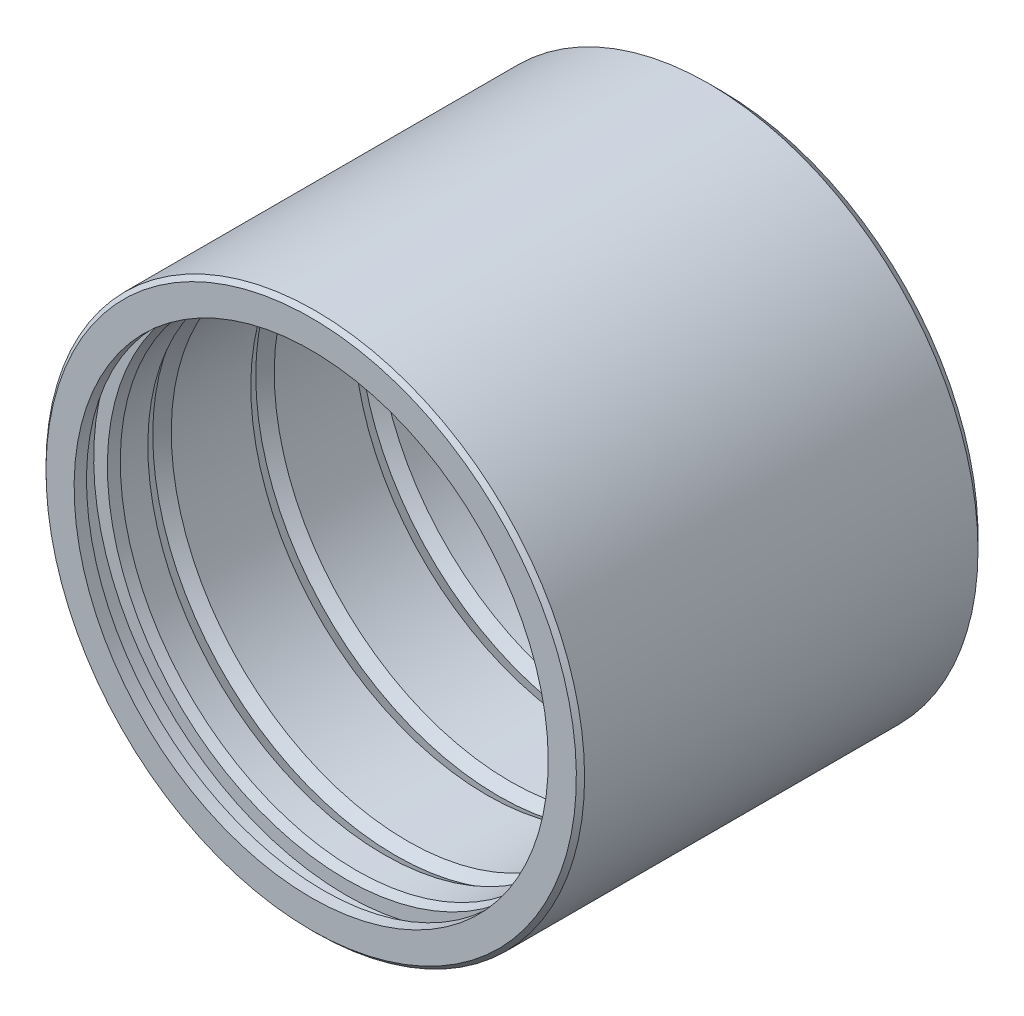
SolidWorks part; units mm, degrees
ref_plane "Front Plane" through (0, 0, 0) normal (0, 0, 1) x (1, 0, 0)
ref_plane "Top Plane" through (0, 0, 0) normal (0, 1, 0) x (1, 0, 0)
ref_plane "Right Plane" through (0, 0, 0) normal (1, 0, 0) x (0, 0, -1)
sketch "Sketch1" plane through (0, 0, 0) normal (1, 0, 0) x (0, 0, -1)
  line L0 (-114.4056, 0) -> (114.4056, 0) construction
  line L2 (-97.5, -115.1) -> (-91.5, -115.1)
  line L3 (-91.5, -115.1) -> (-91.5, -122.6)
  line L4 (-91.5, -122.6) -> (-80.5, -122.6)
  line L5 (-80.5, -122.6) -> (-80.5, -115.95)
  line L6 (-80.5, -115.95) -> (-75.555, -114.625)
  line L7 (-75.555, -114.625) -> (-62.1898, -114.625)
  line L8 (-62.1898, -114.625) -> (-56.5, -117.91)
  line L9 (-56.5, -117.91) -> (-50.8102, -114.625)
  line L10 (-50.8102, -114.625) -> (-12.1898, -114.625)
  line L11 (-12.1898, -114.625) -> (-6.5, -117.91)
  line L12 (-6.5, -117.91) -> (-0.8102, -114.625)
  line L13 (-0.8102, -114.625) -> (37.8102, -114.625)
  line L14 (37.8102, -114.625) -> (43.5, -117.91)
  line L15 (43.5, -117.91) -> (49.1898, -114.625)
  line L17 (93.0096, -114.625) -> (101.5, -116.9)
  line L18 (101.5, -116.9) -> (101.5, -124.75)
  line L19 (101.5, -124.75) -> (95.5, -130.75)
  line L20 (95.5, -130.75) -> (-95.5, -130.75)
  line L21 (-95.5, -130.75) -> (-97.5, -128.75)
  line L22 (-97.5, -128.75) -> (-97.5, -115.1)
  line L23 (-97.5, -128.75) -> (-101.5, -124.75) construction
  line L24 (-101.5, -124.75) -> (-101.5, -115.1) construction
  line L25 (-101.5, -115.1) -> (-97.5, -115.1) construction
  line L26 (98.5, -39.1266) -> (98.5, -163.3534) construction
  line L27 (-56.5, -117.91) -> (43.5, -117.91) construction
  line L28 (-56.5, -117.91) -> (-56.5, 78.762) construction
  line L29 (-6.5, -117.91) -> (-6.5, 78.4795) construction
  line L30 (43.5, -117.91) -> (43.5, 78.4795) construction
  line L31 (0, 0) -> (0, -199.431) construction
  line L32 (49.1898, -114.625) -> (93.0096, -114.625)
  point P4 (0, 0)
  point P6 (0, -130.75)
  point P30 (-6.5, -94.0752)
  point P34 (0, 0)
  point P36 (0, 0)
  point P37 (43.5, -93.8879)
  point P38 (0, 0)
  point P39 (95.5, -86.4869)
  point P40 (0, 0)
  point P41 (0, 0)
  point P42 (43.5, -93.8879)
  point P43 (0, 0)
  point P44 (0, 0)
  point P45 (0, 0)
  point P46 (-70.7866, -113.6631)
  point P47 (0, 0)
  point P48 (73.1711, -115.025)
  point P51 (44.1162, -117.91)
revolve "Revolve1" add sketch "Sketch1" angle 360 about L0
equation "\"sleeve od\"= 261.5'1mm larger than standard"
equation "\"finish id\"= 230.05"
equation "\"finishing allowance\"= 1"
equation "\"welding allowance\"= 3"
equation "\"v groove diameter\"= 235.82"
equation "\"front chamfer length\"= 4"
equation "\"v-groove 1\"= 51"
equation "\"v-groove 2\"= 50"
equation "\"v-groove 3\"= 50"
equation "\"o-ring groove\"= 45"
equation "\"o-ring diameter\"= 245"
equation "\"finish land diameter\"= 231"
equation "\"crush\"= 0.2"
equation "\"D2@Sketch1\"=\"v-groove 1\"+\"v-groove 2\"+\"v-groove 3\"+\"o-ring groove\"+\"front chamfer length\""
equation "\"D3@Sketch1\"=\"welding allowance\""
equation "\"outside weld chamfer\"= 6"
equation "\"D8@Sketch1\" = \"o-ring diameter\" + \"crush\""
equation "\"sleeve land length\"= 6"
equation "\"D14@Sketch1\"=\"outside weld chamfer\""
equation "\"D15@Sketch1\"=\"o-ring groove\""
equation "\"D17@Sketch1\"=\"v-groove 2\""
equation "\"D16@Sketch1\"=\"v-groove 3\""
equation "\"D20@Sketch1\"=\"v groove diameter\""
equation "\"D22@Sketch1\"= \"finish id\" - \"finishing allowance\" + \"crush\""
equation "\"D6@Sketch1\"=\"sleeve od\""
equation "\"D7@Sketch1\"= \"finish land diameter\" - \"finishing allowance\" + \"crush\""
